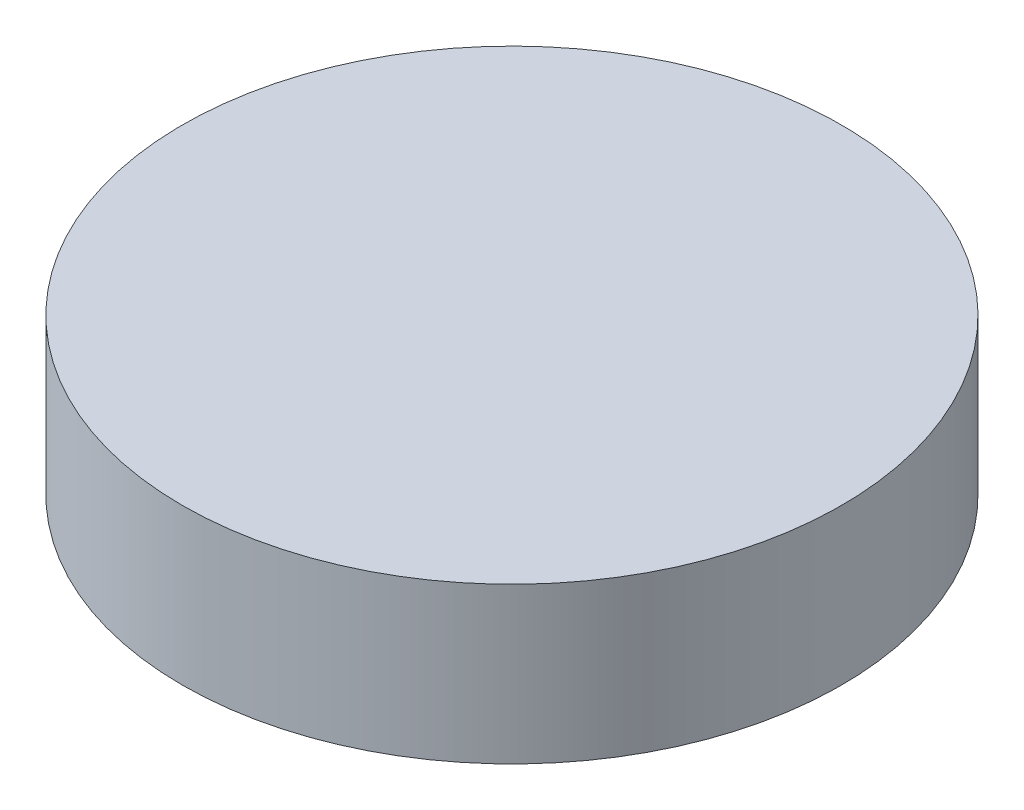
SolidWorks part; units mm, degrees
ref_plane "Front Plane" through (0, 0, 0) normal (0, 0, 1) x (1, 0, 0)
ref_plane "Top Plane" through (0, 0, 0) normal (0, 1, 0) x (1, 0, 0)
ref_plane "Right Plane" through (0, 0, 0) normal (1, 0, 0) x (0, 0, -1)
sketch "Sketch1" plane through (0, 0, 0) normal (0, 1, 0) x (1, 0, 0)
  circle A0 centre (0, 0) radius 45
  dimension "D1" = 90
extrude "Boss-Extrude1" add sketch "Sketch1" along normal blind 21.25
sketch "Sketch2" plane through (0, 0, 0) normal (0, -1, 0) x (1, 0, 0)
  circle A0 centre (0, 0) radius 10
  dimension "D1" = 20
extrude "Cut-Extrude1" cut sketch "Sketch2" against normal blind 20
sketch "Sketch3" plane through (0, 21.25, 0) normal (0, 1, 0) x (1, 0, 0)
  line L1 (35, 35) -> (-35, 35)
  line L2 (35, 35) -> (35, -35)
  line L3 (35, -35) -> (-35, -35)
  line L4 (-35, 35) -> (-35, -35)
  line L5 (35, 35) -> (-35, -35) construction
  line L6 (35, -35) -> (-35, 35) construction
  point P0 (0, 0)
  dimension "D1" = 70
  dimension "D2" = 70
